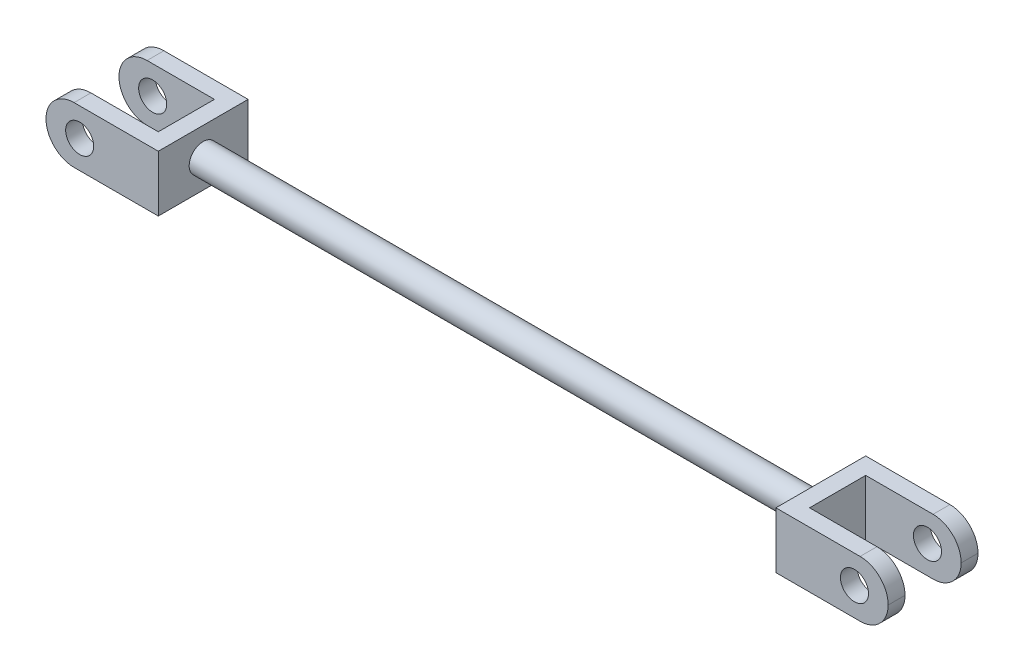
SolidWorks part; units mm, degrees
ref_plane "Front Plane" through (0, 0, 0) normal (0, 0, 1) x (1, 0, 0)
ref_plane "Top Plane" through (0, 0, 0) normal (0, 1, 0) x (1, 0, 0)
ref_plane "Right Plane" through (0, 0, 0) normal (1, 0, 0) x (0, 0, -1)
sketch "Sketch1" plane through (0, 0, 0) normal (0, 1, 0) x (1, 0, 0)
  line L0 (-36.8562, 0) -> (38.8697, 0) construction
  line L1 (0, 5) -> (17, 5)
  line L2 (17, 5) -> (17, -5)
  line L3 (17, 0) -> (20, 0)
  line L4 (20, -8) -> (20, 8)
  line L5 (20, 8) -> (0, 8)
  line L6 (0, 8) -> (0, 5)
  line L7 (0, -8) -> (0, -5)
  line L8 (20, -8) -> (0, -8)
  line L9 (0, -5) -> (17, -5)
  dimension "D1" = 10
  dimension "D2" = 3
  dimension "D3" = 3
  dimension "D4" = 20
extrude "Boss-Extrude1" add sketch "Sketch1" along normal mid plane 10 contours L9 L7 L8 L4 L3 L2 | L5 L6 L1 L2 L3 L4
sketch "Sketch2" plane through (0, 0, 8) normal (0, 0, 1) x (1, 0, 0)
  circle A0 centre (6, 0) radius 2.5
  dimension "D1" = 5
  dimension "D2" = 6
extrude "Cut-Extrude1" cut sketch "Sketch2" against normal through all and the other way through all
fillet "Fillet1" radius 5 4 edges at (0, 5, -6.5) (0, -5, -6.5) (0, -5, 6.5) (0, 5, 6.5)
sketch "Sketch3" plane through (20, 0, 0) normal (1, 0, 0) x (0, 0, -1)
  circle A0 centre (0, 0) radius 2.5
  dimension "D1" = 5
extrude "Boss-Extrude2" add sketch "Sketch3" along normal blind 110
ref_plane "Plane1" through (75, 0, 0) normal (1, 0, 0) x (0, 0, -1)
mirror "Mirror1" about plane through (75, 0, 0) normal (1, 0, 0) of "Fillet1", "Cut-Extrude1", "Boss-Extrude1"
